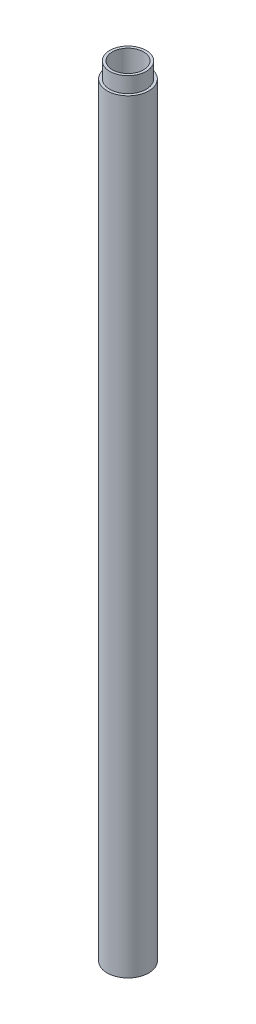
SolidWorks part; units mm, degrees
ref_plane "Přední rovina" through (0, 0, 0) normal (0, 0, 1) x (1, 0, 0)
ref_plane "Horní rovina" through (0, 0, 0) normal (0, 1, 0) x (1, 0, 0)
ref_plane "Pravá rovina" through (0, 0, 0) normal (1, 0, 0) x (0, 0, -1)
sketch "Skica1" plane through (0, 0, 0) normal (0, 1, 0) x (1, 0, 0)
  circle A0 centre (0, 0) radius 4
extrude "Přidat vysunutím1" add sketch "Skica1" along normal blind 150
sketch "Skica2" plane through (0, 150, 0) normal (0, 1, 0) x (1, 0, 0)
  circle A0 centre (0, 0) radius 3
extrude "Odebrat vysunutím1" cut sketch "Skica2" against normal through all
sketch "Skica3" plane through (0, 150, 0) normal (0, 1, 0) x (-1, 0, 0)
  circle A0 centre (0, 0) radius 3.5
extrude "Odebrat vysunutím2" cut sketch "Skica3" against normal blind 3 flip side to cut
